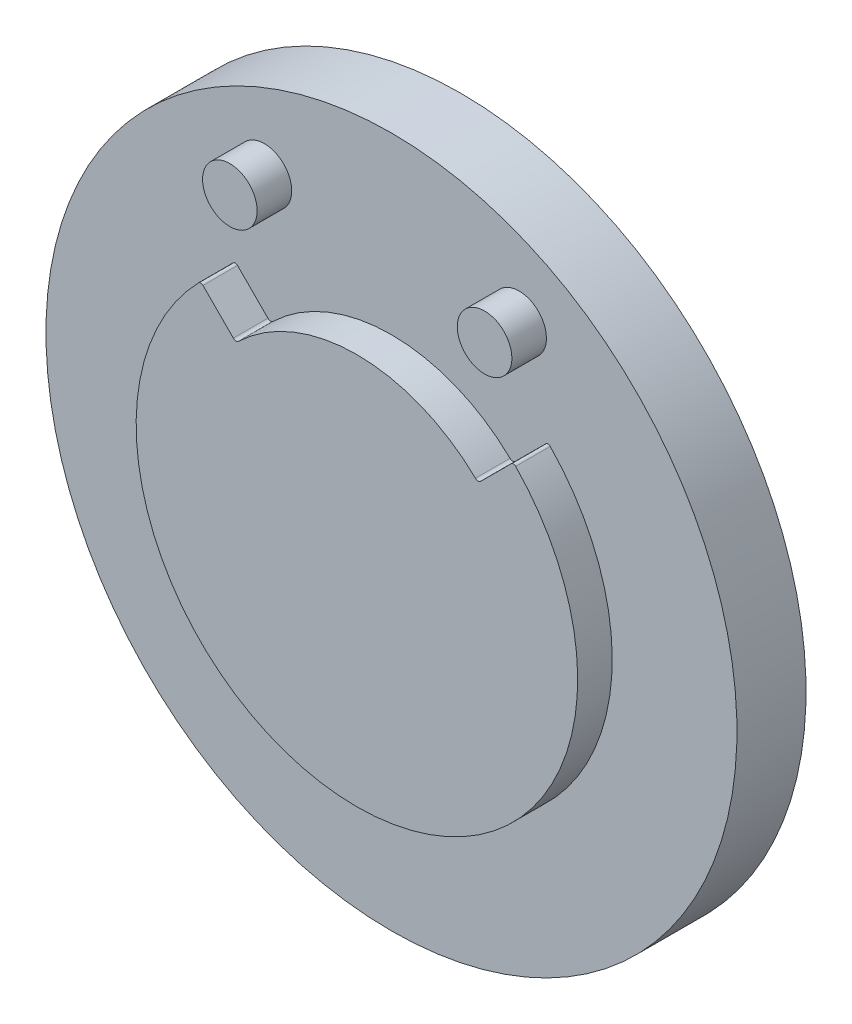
SolidWorks part; units mm, degrees
ref_plane "Plane1" through (0, 0, 0) normal (0, 0, 1) x (1, 0, 0)
ref_plane "Plane2" through (0, 0, 0) normal (0, 1, 0) x (1, 0, 0)
ref_plane "Plane3" through (0, 0, 0) normal (1, 0, 0) x (0, 0, -1)
imported_body "Imported1"
sketch "Sketch1" plane through (0, 0.002, 12.4872) normal (0, 0.0002, 1) x (1, 0, 0)
  line L4 (118.1214, 116.7164) -> (96.0779, 94.7214)
  line L5 (-82.9533, 94.9188) -> (-104.9482, 116.9622)
  line L6 (118.1214, 116.7164) -> (96.0779, 94.7214)
  line L7 (-82.9533, 94.9188) -> (-104.9482, 116.9622)
  circle A0 centre (6.464, 5.6637) radius 165.1
  arc A12 (-108.1496, 116.9404) -> (121.3227, 116.6874) centre (6.464, 5.6637) ccw
  arc A13 (121.3227, 116.6874) -> (118.1214, 116.7164) centre (119.7078, 115.1265) ccw
  arc A14 (92.2221, 94.6875) -> (96.0779, 94.7214) centre (94.1327, 96.6709) ccw
  arc A15 (92.2221, 94.6875) -> (-79.0975, 94.8764) centre (6.464, 5.6637) ccw
  arc A16 (-82.9533, 94.9188) -> (-79.0975, 94.8764) centre (-81.0038, 96.864) ccw
  arc A17 (-104.9482, 116.9622) -> (-108.1496, 116.9404) centre (-106.5381, 115.3758) ccw
  arc A18 (-108.1496, 116.9404) -> (121.3227, 116.6874) centre (6.464, 5.6637) ccw
  arc A19 (121.3227, 116.6874) -> (118.1214, 116.7164) centre (119.7078, 115.1265) ccw
  arc A20 (92.2221, 94.6875) -> (96.0779, 94.7214) centre (94.1327, 96.6709) ccw
  arc A21 (92.2221, 94.6875) -> (-79.0975, 94.8764) centre (6.464, 5.6637) ccw
  arc A22 (-82.9533, 94.9188) -> (-79.0975, 94.8764) centre (-81.0038, 96.864) ccw
  arc A23 (-104.9482, 116.9622) -> (-108.1496, 116.9404) centre (-106.5381, 115.3758) ccw
  dimension "D2" = 330.2
  dimension "D1" = 0.254
extrude "Cut-Extrude2" cut sketch "Sketch1" against normal up to surface (25 mm away)
sketch "Sketch2" plane through (0, 0.002, 12.4872) normal (0, 0.0002, 1) x (1, 0, 0)
  circle A4 centre (-85.503, 183.2645) radius 19.746
  circle A5 centre (-85.503, 183.2645) radius 19.746
  circle A7 centre (-85.503, 183.2645) radius 22.54
  circle A8 centre (-85.503, 183.2645) radius 22.54
  circle A10 centre (98.8224, 183.0614) radius 22.54
  circle A11 centre (98.8224, 183.0614) radius 22.54
  circle A13 centre (98.8224, 183.0614) radius 19.746
  circle A14 centre (98.8224, 183.0614) radius 19.746
  dimension "D1" = 0.254
  dimension "D2" = 2.54
  dimension "D3" = 2.54
  dimension "D4" = 0.254
extrude "Cut-Extrude3" cut sketch "Sketch2" against normal up to surface (25 mm away)
